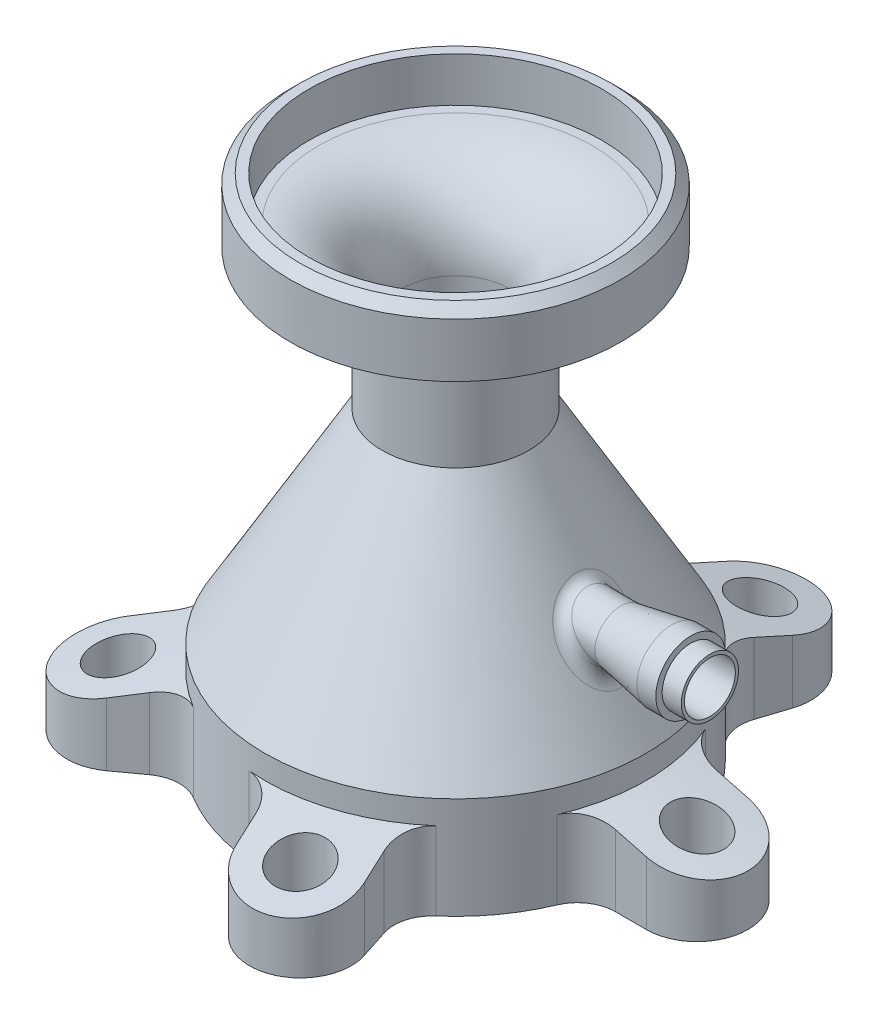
SolidWorks part; units mm, degrees
ref_plane "前视基准面" through (0, 0, 0) normal (0, 0, 1) x (1, 0, 0)
ref_plane "上视基准面" through (0, 0, 0) normal (0, 1, 0) x (1, 0, 0)
ref_plane "右视基准面" through (0, 0, 0) normal (1, 0, 0) x (0, 0, -1)
other "Configuration Table"
sketch "草图1" plane through (0, 0, 0) normal (0, 0, 1) x (1, 0, 0)
  line L0 (0, 0) -> (0, 82.042) construction
  line L1 (30, 0) -> (30, 16)
  line L2 (30, 16) -> (11.5248, 48)
  line L3 (11.5248, 48) -> (11.5248, 60)
  line L4 (21.5248, 70) -> (26, 70)
  line L5 (26, 70) -> (26, 80)
  line L6 (26, 80) -> (0, 80)
  line L7 (30, 0) -> (0, 0)
  line L8 (0, 0) -> (0, 80)
  arc A0 (11.5248, 60) -> (21.5248, 70) centre (21.5248, 60) cw
  point P12 (11.5248, 70)
  dimension "D8" = 10
  dimension "D1" = 60
  dimension "D2" = 30
  dimension "D3" = 16
  dimension "D4" = 32
  dimension "D5" = 22
  dimension "D6" = 10
  dimension "D7" = 52
revolve "旋转1" add sketch "草图1" angle 360 about L0
sketch "草图2" plane through (0, 0, 0) normal (0, 0, 1) x (1, 0, 0)
  line L0 (-6.4847, 30) -> (46.2841, 30) construction
  line L1 (0, 34.0894) -> (26, 34.0894)
  line L2 (26, 34.0894) -> (34, 35.5)
  line L3 (34, 35.5) -> (40, 35.5)
  line L4 (40, 35.5) -> (40, 30)
  line L5 (0, 34.0894) -> (0, 30)
  line L6 (40, 30) -> (0, 30)
  point P5 (0, 0)
  point P10 (0, 0)
  dimension "D1" = 30
  dimension "D2" = 6
  dimension "D3" = 10
  dimension "D4" = 8
  dimension "D5" = 11
  dimension "D6" = 40
revolve "旋转2" add sketch "草图2" angle 360 about L0
shell "抽壳1" thickness 3
sketch "草图3" plane through (0, 0, 0) normal (0, 1, 0) x (1, 0, 0)
  line L0 (0, 0) -> (38, 0) construction
  line L1 (38, 0) -> (-19.5316, 0) construction
  line L2 (38, -8) -> (-19.5316, -8)
  line L3 (38, 8) -> (-19.5316, 8)
  circle A0 centre (38, 0) radius 4.2
  arc A1 (38, -8) -> (38, 8) centre (38, 0) ccw
  arc A2 (-19.5316, 8) -> (-19.5316, -8) centre (-19.5316, 0) ccw
  circle A3 centre (0, 0) radius 30 construction
  circle A4 centre (0, 0) radius 30
  point P3 (9.2342, 0)
  point P10 (0, 0)
  point P11 (0, 0)
  point P13 (0, 0)
  point P14 (0, 0)
  point P15 (0, 0)
  point P16 (9.2342, 0)
  dimension "D1" = 8.4
  dimension "D2" = 8
  dimension "D3" = 38
  dimension "D4" = 57.5316
extrude "凸台-拉伸1" add sketch "草图3" along normal blind 16 contours A4 L2 A1 L3 A0
fillet "圆角1" radius 6 2 edges at (28.9137, 8, 8) (28.9137, 8, -8)
pattern_circular "阵列(圆周)2" count 5 over 360 about axis through (0, 0, 0) along (0, 1, 0) of "圆角1", "凸台-拉伸1"
sketch "草图4" plane through (0, 0, 0) normal (0, 0, 1) x (1, 0, 0)
  line L0 (46, 8) -> (30, 12.2872)
  line L3 (30, 12.2872) -> (30, 20.9066)
  line L4 (30, 20.9066) -> (46, 20.9066)
  line L5 (46, 20.9066) -> (46, 8)
  dimension "D1" = 15
  dimension "D2" = 8
  dimension "D3" = 30
  dimension "D4" = 46
revolve "切除-旋转1" cut sketch "草图4" angle 360 about axis through (0, 0, 0) along (0, -1, 0)
sketch "草图5" plane through (40, 0, 0) normal (1, 0, 0) x (0, 0, -1)
  circle A0 centre (0, 30) radius 4.5
  dimension "D1" = 9
extrude "切除-拉伸-薄壁1" cut sketch "草图5" against normal blind 3 thin
chamfer "倒角1" distance 1.5 angle 45 1 edges at (0, 80, -26)
fillet "圆角2" radius 2 1 edges at (22.5313, 28.396, 3.7617)
